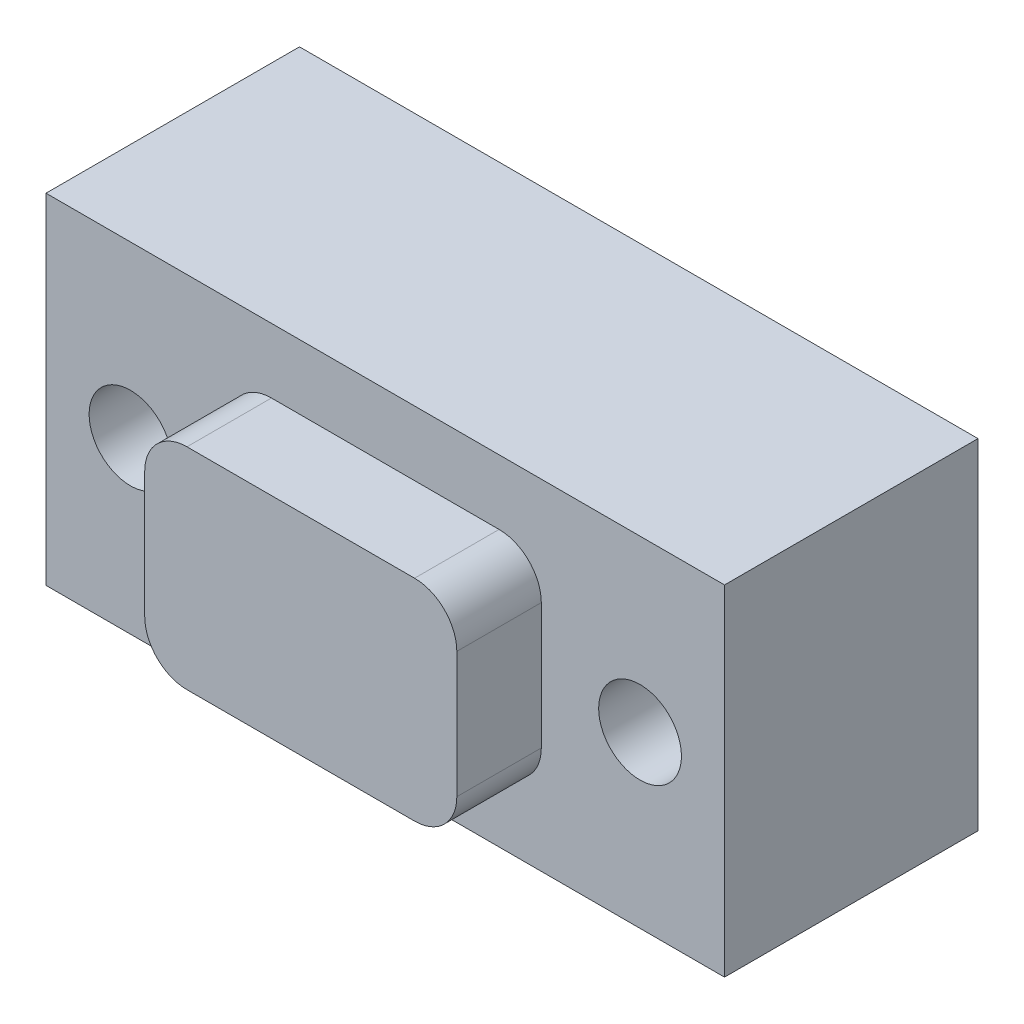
SolidWorks part; units mm, degrees
ref_plane "Front Plane" through (0, 0, 0) normal (0, 0, 1) x (1, 0, 0)
ref_plane "Top Plane" through (0, 0, 0) normal (0, 1, 0) x (1, 0, 0)
ref_plane "Right Plane" through (0, 0, 0) normal (1, 0, 0) x (0, 0, -1)
sketch "Sketch1" plane through (0, 0, 0) normal (0, 0, 1) x (1, 0, 0)
  line L1 (-9.9949, -5.0038) -> (9.9949, -5.0038)
  line L2 (-9.9949, -5.0038) -> (-9.9949, 5.0038)
  line L3 (-9.9949, 5.0038) -> (9.9949, 5.0038)
  line L4 (9.9949, -5.0038) -> (9.9949, 5.0038)
  line L5 (-9.9949, -5.0038) -> (9.9949, 5.0038) construction
  line L6 (-9.9949, 5.0038) -> (9.9949, -5.0038) construction
  point P0 (0, 0)
  dimension "D1" = 10.0076
  dimension "D2" = 19.9898
extrude "Boss-Extrude1" add sketch "Sketch1" against normal blind 7.4676
sketch "Sketch2" plane through (0, 0, 0) normal (0, 0, 1) x (1, 0, 0)
  line L1 (-3.3528, -3.0988) -> (3.3528, -3.0988)
  line L2 (-4.5974, -1.8542) -> (-4.5974, 1.8542)
  line L3 (-3.3528, 3.0988) -> (3.3528, 3.0988)
  line L4 (4.5974, -1.8542) -> (4.5974, 1.8542)
  line L5 (-4.5974, -3.0988) -> (4.5974, 3.0988) construction
  line L6 (-4.5974, 3.0988) -> (4.5974, -3.0988) construction
  arc A0 (4.5974, 1.8542) -> (3.3528, 3.0988) centre (3.3528, 1.8542) ccw
  arc A1 (-3.3528, -3.0988) -> (-4.5974, -1.8542) centre (-3.3528, -1.8542) cw
  arc A2 (3.3528, -3.0988) -> (4.5974, -1.8542) centre (3.3528, -1.8542) ccw
  arc A3 (-3.3528, 3.0988) -> (-4.5974, 1.8542) centre (-3.3528, 1.8542) ccw
  point P0 (0, 0)
  dimension "D3" = 1.2446
  dimension "D1" = 9.1948
  dimension "D2" = 6.1976
extrude "Boss-Extrude2" add sketch "Sketch2" along normal blind 2.4892
hole_wizard "#2 Clearance Hole1" positions "Sketch4" profile "Sketch3" hole size "#2" standard "ANSI Inch"
sketch "Sketch4" plane through (0, 0, -7.4676) normal (0, 0, -1) x (-1, 0, 0)
  line L0 (-7.5057, 0) -> (7.5057, 0) construction
  point P0 (-7.5057, 0)
  point P2 (7.5057, 0)
  dimension "D1" = 15.0114
sketch "Sketch3" plane through (7.5057, 0, -7.4676) normal (1, 0, 0) x (0, 1, 0)
  line L0 (0, 0) -> (0, 9.9568)
  line L1 (0, 9.9568) -> (1.2192, 9.9568)
  line L2 (1.2192, 9.9568) -> (1.2192, 0)
  line L5 (1.2192, 0) -> (0, 0)
  line L11 (0, -6.35) -> (0, 107.95) construction
  dimension "Thru Hole Dia." = 2.4384
  dimension "Thru Hole Depth" = 9.9568
